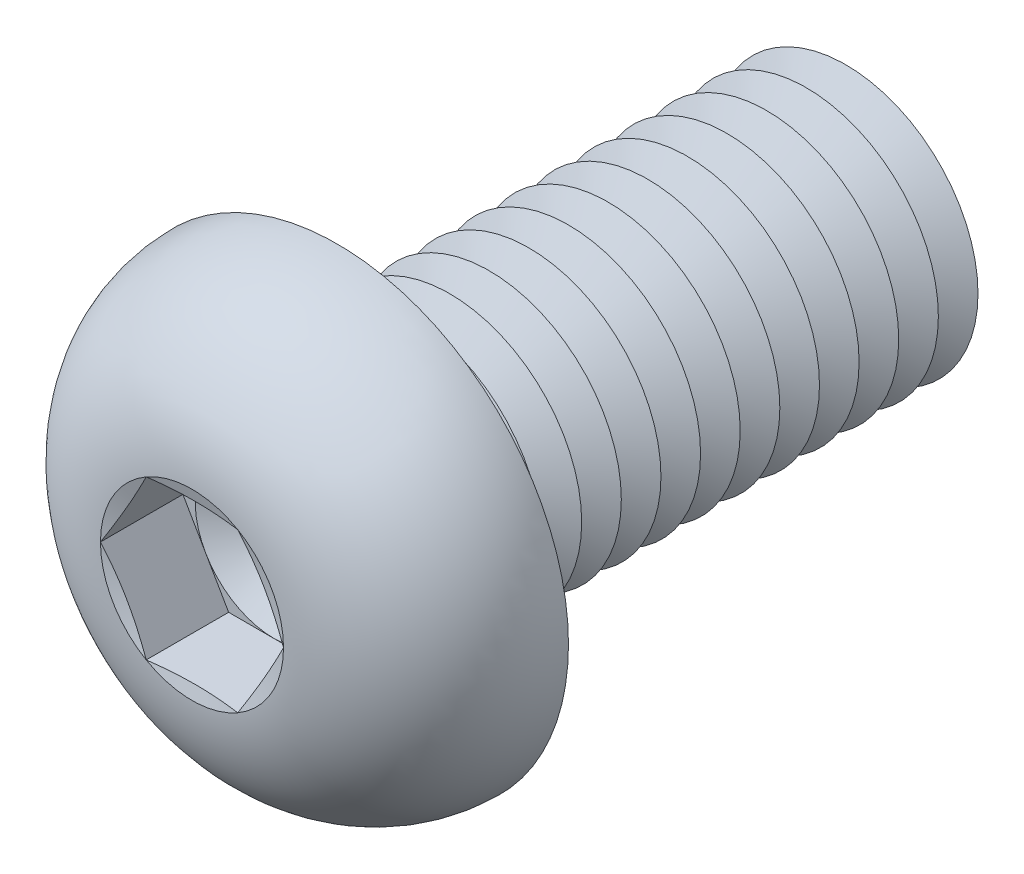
SolidWorks part; units mm, degrees
ref_plane "Front Plane" through (0, 0, 0) normal (0, 0, 1) x (1, 0, 0)
ref_plane "Top Plane" through (0, 0, 0) normal (0, 1, 0) x (1, 0, 0)
ref_plane "Right Plane" through (0, 0, 0) normal (1, 0, 0) x (0, 0, -1)
sketch "Sketch1" plane through (0, 0, 0) normal (1, 0, 0) x (0, 0, -1)
  line L0 (0, 5) -> (0, 8.75)
  line L3 (0, 5) -> (20, 5)
  line L4 (20, 5) -> (20, 0)
  line L5 (20, 0) -> (-5.5, 0) construction
  line L6 (-5.5, 0) -> (20, 0)
  line L7 (-5.5, 3.4641) -> (-5.5, 1.732) construction
  line L8 (-5.5, 1.732) -> (-5.5, 0)
  line L9 (-5.5, 3.4641) -> (-5.0359, 1.732)
  line L10 (-5.0359, 1.732) -> (-5.5, 1.732)
  line L11 (20, 0) -> (22.7481, 0) construction
  line L12 (0, 8.75) -> (-5.5, 8.75) construction
  arc A1 (0, 8.75) -> (-5.5, 3.4641) centre (0, 3.2457) ccw
  point P8 (20, 2.5)
  dimension "D1" = 17.5
  dimension "D2" = 10
  dimension "D3" = 5.5
  dimension "D4" = 6.9282
  dimension "D5" = 20
  dimension "D6" = 15
revolve "Revolve1" add sketch "Sketch1" angle 360 about L5
fillet "Fillet1" radius 0.75 1 edges at (-5, 0, 0)
sketch "Sketch2" plane through (0, 0, 0) normal (1, 0, 0) x (0, 0, -1)
  line L0 (19.25, 5) -> (20.75, 5)
  line L1 (20, 5) -> (0.75, 5) construction
  line L2 (20.75, 5) -> (20, 3.701)
  line L3 (20, -5) -> (20, 5) construction
  line L4 (20, 3.701) -> (19.25, 5)
  dimension "D1" = 1.5
revolve "Cut-Revolve1" cut sketch "Sketch2" angle 360 about axis through (0, 0, -20) along (0, 0, -1)
pattern_linear "LPattern1" count 13 spacing 1.5 along (0, 0, 1) of "Cut-Revolve1"
sketch "Sketch3" plane through (0, 0, 5.5) normal (0, 0, 1) x (1, 0, 0)
  line L7 (1.732, 3) -> (-1.7321, 3)
  line L8 (-1.7321, 3) -> (-3.4641, 0)
  line L9 (-3.4641, 0) -> (-1.732, -3)
  line L10 (-1.732, -3) -> (1.732, -3)
  line L11 (1.732, -3) -> (3.4641, 0)
  line L12 (3.4641, 0) -> (1.732, 3)
  circle A0 centre (0, 0) radius 3 construction
  circle A3 centre (0, 0) radius 3.4641 construction
extrude "Cut-Extrude1" cut sketch "Sketch3" against normal blind 3.12
sketch "Sketch4" plane through (0, 0, 2.38) normal (0, 0, 1) x (1, 0, 0)
  line L1 (1.732, 3) -> (-1.7321, 3) construction
  circle A0 centre (0, 0) radius 3
extrude "Cut-Extrude2" cut sketch "Sketch4" against normal through all draft 60
